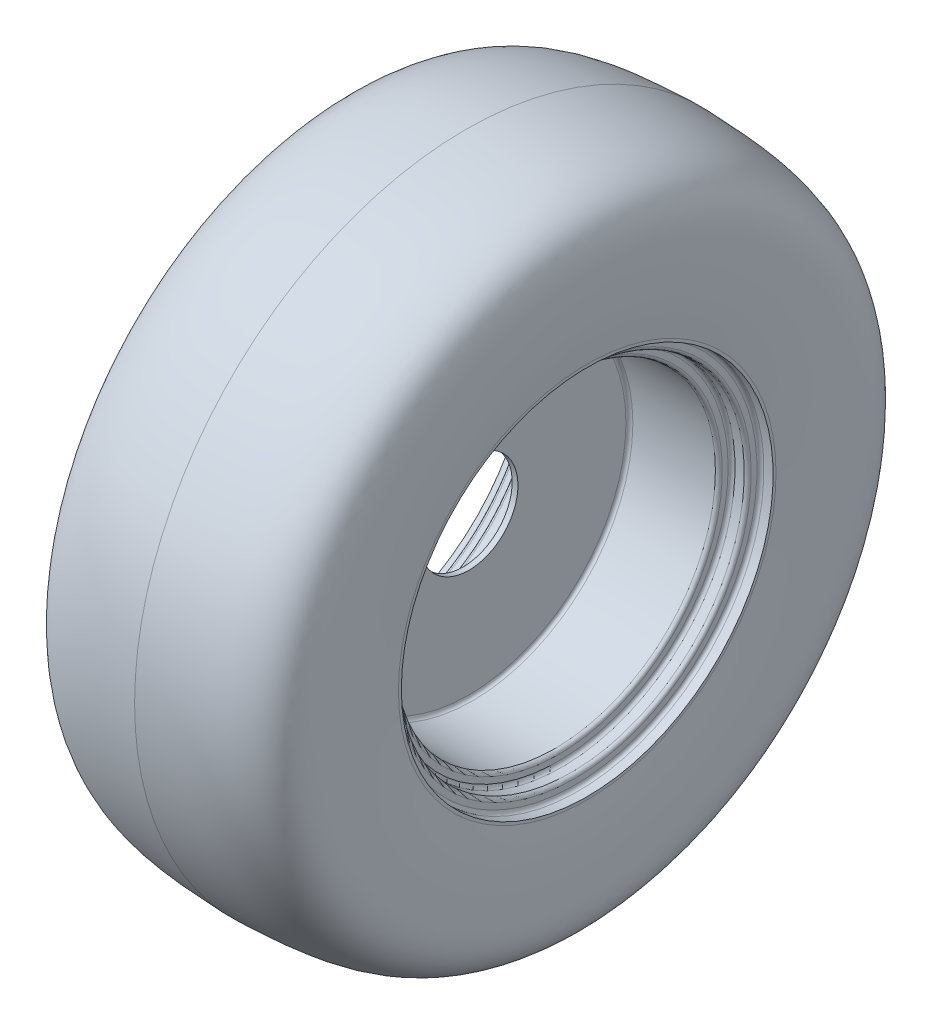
SolidWorks part; units mm, degrees
ref_plane "Plan de face" through (0, 0, 0) normal (0, 0, 1) x (1, 0, 0)
ref_plane "Plan de dessus" through (0, 0, 0) normal (0, 1, 0) x (1, 0, 0)
ref_plane "Plan de droite" through (0, 0, 0) normal (1, 0, 0) x (0, 0, -1)
sketch "Esquisse1" plane through (0, 0, 0) normal (0, 1, 0) x (1, 0, 0)
  line L0 (-61.187, 0) -> (61.187, 0) construction
  line L1 (0, 0) -> (0, 287) construction
  line L2 (-105, 163.5) -> (-105, 161)
  line L3 (-105, 161) -> (-97, 161)
  line L4 (-94, 158) -> (-94, 153)
  line L5 (-91, 150) -> (-83, 150)
  line L6 (-80, 147) -> (-80, 142)
  line L7 (-77, 139) -> (-5.5, 139)
  line L8 (-2.5, 136) -> (-2.5, 42.5)
  line L9 (-2.5, 42.5) -> (2.5, 42.5)
  line L10 (2.5, 136) -> (2.5, 42.5)
  line L11 (77, 139) -> (5.5, 139)
  line L12 (80, 147) -> (80, 142)
  line L13 (91, 150) -> (83, 150)
  line L14 (94, 158) -> (94, 153)
  line L15 (105, 161) -> (97, 161)
  line L16 (105, 163.5) -> (105, 161)
  arc A0 (-5.5, 139) -> (-2.5, 136) centre (-5.5, 136) cw
  arc A1 (-80, 142) -> (-77, 139) centre (-77, 142) ccw
  arc A2 (-83, 150) -> (-80, 147) centre (-83, 147) cw
  arc A3 (-94, 153) -> (-91, 150) centre (-91, 153) ccw
  arc A4 (-97, 161) -> (-94, 158) centre (-97, 158) cw
  arc A5 (97, 161) -> (94, 158) centre (97, 158) ccw
  arc A6 (94, 153) -> (91, 150) centre (91, 153) cw
  arc A7 (83, 150) -> (80, 147) centre (83, 147) ccw
  arc A8 (80, 142) -> (77, 139) centre (77, 142) cw
  arc A9 (5.5, 139) -> (2.5, 136) centre (5.5, 136) ccw
  spline S0 degree 3 poles (0, 287) (-48.8582, 285.2212) (-109.6172, 283.0091) (-107.401, 220.3811) (-107.4597, 192.0476) (-105.7393, 172.0809) (-105, 163.5) knots 0 0 0 0 0.562801 0.699887 0.871023 1 1 1 1
  spline S1 degree 3 poles (0, 287) (48.8582, 285.2212) (109.6172, 283.0091) (107.401, 220.3811) (107.4597, 192.0476) (105.7393, 172.0809) (105, 163.5) knots 0 0 0 0 0.562801 0.699887 0.871023 1 1 1 1
  point P47 (0, 42.5)
  dimension "D11" = 3
  dimension "D1" = 574
  dimension "D2" = 2.5
  dimension "D3" = 105
  dimension "D4" = 161
  dimension "D5" = 94
  dimension "D6" = 80
  dimension "D7" = 2.5
  dimension "D8" = 85
  dimension "D9" = 139
  dimension "D10" = 150
revolve "Révolution1" add sketch "Esquisse1" angle 360 about L0
